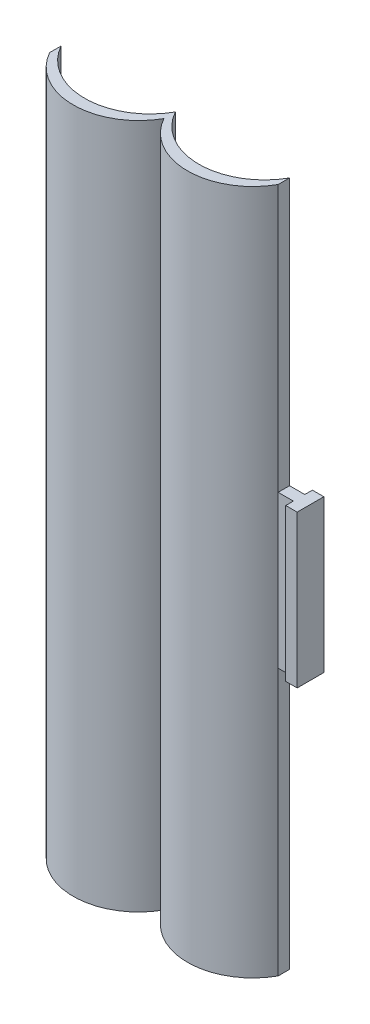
SolidWorks part; units mm, degrees
ref_plane "Front Plane" through (0, 0, 0) normal (0, 0, 1) x (1, 0, 0)
ref_plane "Top Plane" through (0, 0, 0) normal (0, 1, 0) x (1, 0, 0)
ref_plane "Right Plane" through (0, 0, 0) normal (1, 0, 0) x (0, 0, -1)
sketch "Sketch1" plane through (0, 0, 0) normal (0, 1, 0) x (1, 0, 0)
  line L0 (0, 0) -> (0, -3)
  line L1 (-30, 0) -> (-30, -3) construction
  line L2 (-60, 0) -> (-60, -3)
  arc A0 (0, 0) -> (-30, 0) centre (-15, 8.373) cw
  arc A1 (0, -3) -> (-30, -3) centre (-15, 5.373) cw
  arc A2 (-60, -3) -> (-30, -3) centre (-45, 5.373) ccw
  arc A3 (-60, 0) -> (-30, 0) centre (-45, 8.373) ccw
  point P7 (0, 0)
extrude "Boss-Extrude1" add sketch "Sketch1" along normal blind 180
sketch "Sketch2" plane through (0, 0, 0) normal (0, 0, 1) x (1, 0, 0)
  line L0 (-24.1021, 0) -> (-24.1021, 90) construction
  line L1 (-30, 0) -> (0, 0) construction
ref_plane "Plane1" through (0, 90, 0) normal (0, 1, 0) x (1, 0, 0)
sketch "Sketch3" plane through (0, 90, 0) normal (0, 1, 0) x (1, 0, 0)
  line L0 (4, -3) -> (4, -5)
  line L1 (0, 0) -> (4, 0)
  line L2 (0, 0) -> (0, -3)
  line L3 (0, -3) -> (4, -3)
  line L5 (4, 2) -> (7, 2)
  line L6 (4, 2) -> (4, 0)
  line L7 (4, -5) -> (7, -5)
  line L8 (7, 2) -> (7, -5)
  point P9 (7, -1.5)
  point P10 (0, -1.5)
extrude "Boss-Extrude2" add sketch "Sketch3" along normal mid plane 40
equation "\"ExternalDiameterBallBearing\" = 22mm"
equation "\"InternalDiameterBallBearing\"= 8mm"
equation "\"WidthJoints\"= 3mm"
equation "\"Widthblade\"= 3mm"
equation "\"LenghtJoints\"= 7mm"
equation "\"HeightJoints\"= 40mm"
equation "\"DeepnessJoints\"= 60mm"
equation "\"TurbineShaftDiameter\"= 40mm"
equation "\"HeightTurbine\"= 180mm"
equation "\"HeightBase\"= 20mm"
equation "\"HeightBlade\"= 180mm"
equation "\"HeightBallBearing\"= 7mm"
equation "\"HeightBox\"= 40mm"
equation "\"LenghtBlade\"= 60mm"
equation "\"Lsqare\"= 90mm"
equation "\"lenghtJointsForBox\"=30mm"
equation "\"ErrorForJoints1\"=0.6mm"
equation "\"ErrorForJoints2\"=0.4mm"
equation "\"ErrorForJointsBlade\"=1mm"
equation "\"D1@Sketch1\"=\"WidthJoints\""
equation "\"D2@Sketch1\"=\"LenghtBlade\"/2"
equation "\"D3@Sketch1\"=\"WidthJoints\""
equation "\"D4@Sketch1\"=\"WidthJoints\""
equation "\"D1@Boss-Extrude1\"=\"HeightBlade\""
equation "\"D1@Sketch2\"=\"HeightBlade\"/2"
equation "\"D1@Sketch3\"=\"WidthJoints\"+\"ErrorForJointsBlade\""
equation "\"D2@Sketch3\"=\"LenghtJoints\""
equation "\"D3@Sketch3\"=\"WidthJoints\""
equation "\"D4@Sketch3\"=\"WidthJoints\""
equation "\"D1@Boss-Extrude2\"=\"HeightJoints\""
